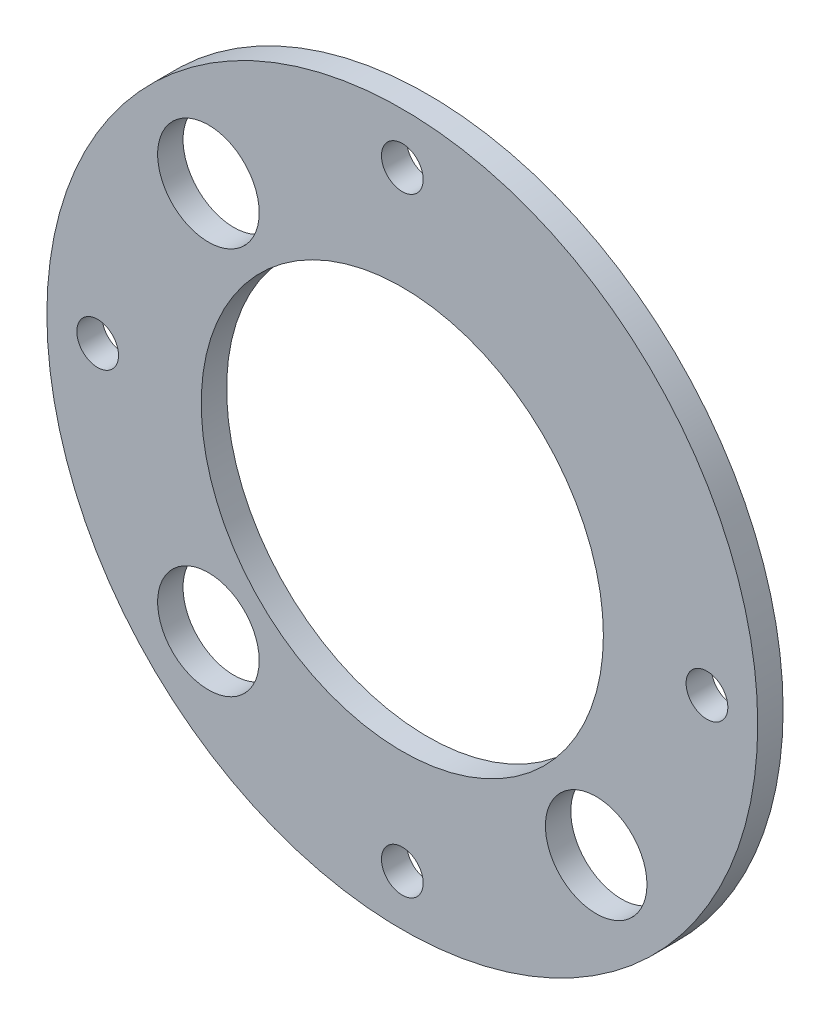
SolidWorks part; units mm, degrees
ref_plane "Front Plane" through (0, 0, 0) normal (0, 0, 1) x (1, 0, 0)
ref_plane "Top Plane" through (0, 0, 0) normal (0, 1, 0) x (1, 0, 0)
ref_plane "Right Plane" through (0, 0, 0) normal (1, 0, 0) x (0, 0, -1)
sketch "Sketch1" plane through (0, 0, 0) normal (0, 0, 1) x (1, 0, 0)
  circle A0 centre (0, 0) radius 25.146
  circle A1 centre (0, 0) radius 44.45
  dimension "D1" = 88.9
  dimension "1.96" = 50.292
extrude "Boss-Extrude1" add sketch "Sketch1" along normal blind 3.175
sketch "Sketch2" plane through (0, 0, 3.175) normal (0, 0, 1) x (1, 0, 0)
  line L0 (0, 0) -> (0, 38.1) construction
  line L1 (0, 0) -> (38.1, 0) construction
  line L2 (0, 0) -> (0, -38.1) construction
  line L3 (0, 0) -> (-38.1, 0) construction
  point P7 (-38.1, 0)
  point P8 (0, 38.1)
  point P9 (38.1, 0)
  point P10 (0, -38.1)
  dimension "D2" = 38.1
hole_wizard "#5 (0.2055) Diameter Hole1" positions "Sketch3" profile "Sketch4" hole size "#5" standard "ANSI Inch"
sketch "Sketch3" plane through (0, 0, 0) normal (0, 0, -1) x (-1, 0, 0)
  point P0 (0, 38.1)
  point P3 (38.1, 0)
  point P6 (0, -38.1)
  point P9 (-38.1, 0)
sketch "Sketch4" plane through (0, 38.1, 0) normal (1, 0, 0) x (0, 1, 0)
  line L0 (0, 0) -> (0, 3.175)
  line L1 (0, 3.175) -> (2.6098, 3.175)
  line L2 (2.6098, 3.175) -> (2.6098, 0)
  line L5 (2.6098, 0) -> (0, 0)
  line L11 (0, -6.35) -> (0, 107.95) construction
  dimension "Thru Hole Dia." = 5.2197
  dimension "Thru Hole Depth" = 3.175
sketch "Sketch5" plane through (0, 0, 3.175) normal (0, 0, 1) x (1, 0, 0)
  circle A0 centre (24.2467, -24.2467) radius 6.35 construction
  circle A1 centre (-24.2467, -24.2467) radius 6.35 construction
  circle A2 centre (-24.2467, 24.2467) radius 6.35 construction
  circle A3 centre (24.2467, -24.2467) radius 6.35
  circle A4 centre (-24.2467, -24.2467) radius 6.35
  circle A5 centre (-24.2467, 24.2467) radius 6.35
extrude "Cut-Extrude1" cut sketch "Sketch5" against normal through all
